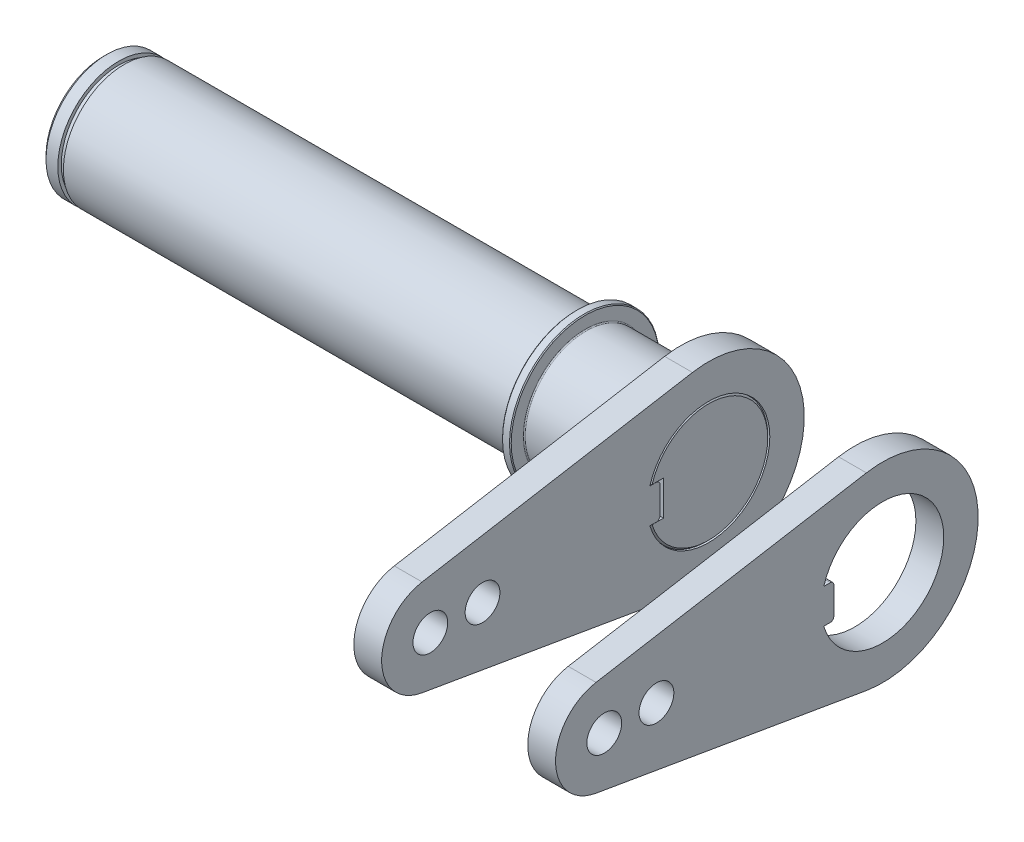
SolidWorks part; units mm, degrees
ref_plane "Plan de face" through (0, 0, 0) normal (0, 0, 1) x (1, 0, 0)
ref_plane "Plan de dessus" through (0, 0, 0) normal (0, 1, 0) x (1, 0, 0)
ref_plane "Plan de droite" through (0, 0, 0) normal (1, 0, 0) x (0, 0, -1)
sketch "Esquisse1" plane through (0, 0, 0) normal (0, 0, 1) x (1, 0, 0)
  line L0 (0, 0) -> (34.5, 0)
  line L1 (34.5, 0) -> (34.5, 17)
  line L2 (34.5, 17) -> (34, 17.5)
  line L3 (34, 17.5) -> (-0.7, 17.5)
  line L4 (-1, 17.8) -> (-1, 21.25)
  line L5 (-1.25, 21.5) -> (-3.25, 21.5)
  line L6 (-3.5, 21.25) -> (-3.5, 17.5)
  line L7 (-3.5, 17.5) -> (-133.5, 17.5)
  line L8 (-133.5, 17.5) -> (-133.5, 16.5)
  line L9 (-133.5, 16.5) -> (-135.1, 16.5)
  line L10 (-135.1, 16.5) -> (-135.1, 17.5)
  line L11 (-135.1, 17.5) -> (-138.5, 17.5)
  line L12 (-139.5, 16.5) -> (-139.5, 0)
  line L13 (-139.5, 0) -> (0, 0)
  line L14 (-138.5, 17.5) -> (-139.5, 16.5)
  line L15 (-3.25, 21.5) -> (-3.5, 21.25)
  line L16 (-1, 21.25) -> (-1.25, 21.5)
  arc A0 (-0.7, 17.5) -> (-1, 17.8) centre (-0.7, 17.8) cw
  point P6 (-1, 21.5)
  point P7 (-3.5, 21.5)
  point P13 (-139.5, 17.5)
  point P23 (-1, 17.5)
  dimension "D12" = 0.3
  dimension "D1" = 34.5
  dimension "D2" = 0.5
  dimension "D3" = 0.5
  dimension "D4" = 35
  dimension "D5" = 2.5
  dimension "D6" = 4
  dimension "D7" = 17.5
  dimension "D8" = 6
  dimension "D9" = 130
  dimension "D10" = 4.4
  dimension "D11" = 1
revolve "Révolution1" add sketch "Esquisse1" angle 360 mid plane about L13
sketch "Esquisse2" plane through (34.5, 0, 0) normal (1, 0, 0) x (0, 0, -1)
  line L0 (-4.6406, 27.1056) -> (-82.3625, 13.7992)
  line L1 (-82.3625, -13.7992) -> (-4.6406, -27.1056)
  line L2 (-80, 0) -> (0, 0) construction
  line L3 (0, 0) -> (-80, 0) construction
  line L4 (-16.8896, 4.95) -> (-15, 4.95)
  line L5 (-14, 3.95) -> (-14, -3.95)
  line L6 (-15, -4.95) -> (-16.8896, -4.95)
  arc A0 (-4.6406, -27.1056) -> (-4.6406, 27.1056) centre (0, 0) ccw
  circle A1 centre (-80, 0) radius 5
  arc A2 (-82.3625, 13.7992) -> (-82.3625, -13.7992) centre (-80, 0) ccw
  arc A4 (-14, -3.95) -> (-15, -4.95) centre (-15, -3.95) cw
  arc A5 (-15, 4.95) -> (-14, 3.95) centre (-15, 3.95) cw
  circle A6 centre (-65, 0) radius 5
  arc A9 (-16.8896, -4.95) -> (-16.8896, 4.95) centre (0, 0) ccw
  dimension "D2" = 10
  dimension "D3" = 14
  dimension "D4" = 27.5
  dimension "D6" = 65
  dimension "D9" = 10
  dimension "D10" = 17.6
  dimension "D5" = 1
  dimension "D1" = 80
  dimension "D7" = 4.95
  dimension "D8" = 14
extrude "Boss.-Extru.1" add sketch "Esquisse2" against normal blind 8 separate body
sketch "Esquisse14" plane through (0, 0, 0) normal (0, 1, 0) x (1, 0, 0)
  line L0 (55.7596, -13) -> (24.5, -13)
  line L1 (-0.7, -17.5) -> (34, -17.5) construction
  line L2 (55.7596, -13) -> (55.7596, -19.906)
  line L3 (55.7596, -19.906) -> (16.1484, -17.5)
  line L4 (34.5, -4.6406) -> (34.5, 27.5) construction
  arc A0 (24.5, -13) -> (16.1484, -17.5) centre (24.5, -23) ccw
  dimension "D2" = 10
  dimension "D1" = 13
  dimension "D3" = 10
extrude "Enlèv. mat.-Extru.6" cut sketch "Esquisse14" against normal mid plane 10
pattern_linear "Répétition linéaire3" count 2 spacing 50 along (1, 0, 0)
